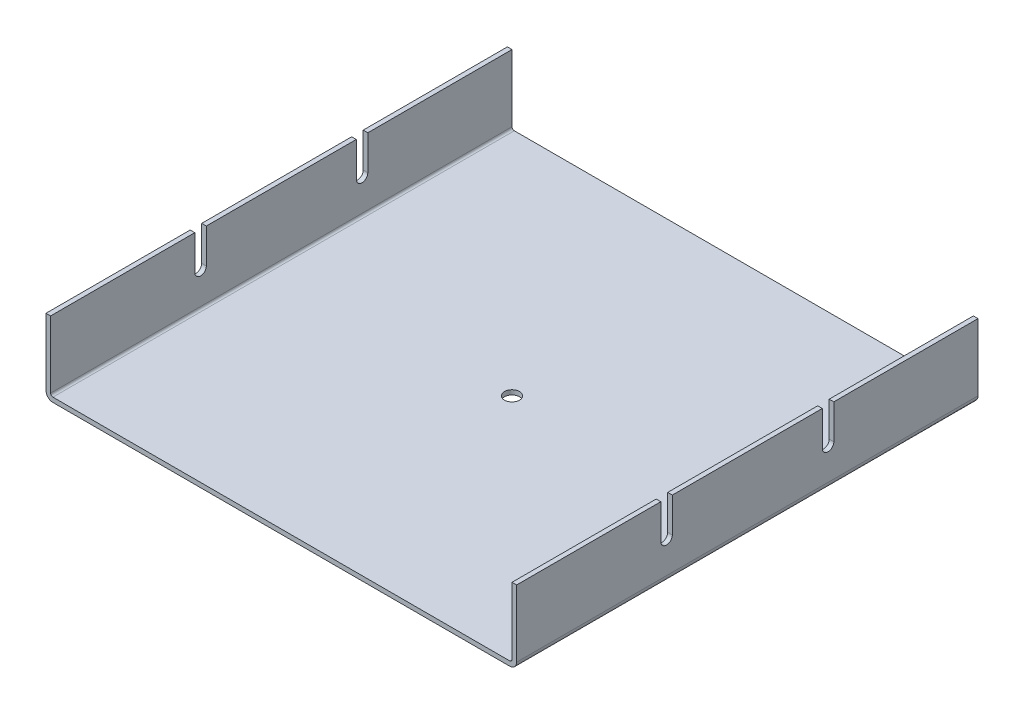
SolidWorks part; units mm, degrees
ref_plane "Plan de face" through (0, 0, 0) normal (0, 0, 1) x (1, 0, 0)
ref_plane "Plan de dessus" through (0, 0, 0) normal (0, 1, 0) x (1, 0, 0)
ref_plane "Plan de droite" through (0, 0, 0) normal (1, 0, 0) x (0, 0, -1)
sketch "Esquisse1" plane through (0, 0, 0) normal (0, 0, 1) x (1, 0, 0)
  line L0 (102, 1) -> (102, 30)
  line L1 (-99, 0) -> (99, 0)
  line L2 (-100, 1) -> (-100, 30)
  line L3 (-99, -2) -> (99, -2)
  line L4 (100, 1) -> (100, 30)
  line L5 (-102, 1) -> (-102, 30)
  line L6 (-102, 30) -> (-100, 30)
  line L7 (100, 30) -> (102, 30)
  line L8 (-100, 0) -> (100, 0) construction
  line L9 (-100, 0) -> (-100, 30) construction
  line L10 (100, 0) -> (100, 30) construction
  line L11 (-102, -2) -> (102, -2) construction
  line L12 (-102, -2) -> (-102, 30) construction
  line L13 (102, -2) -> (102, 30) construction
  arc A0 (-99, 0) -> (-100, 1) centre (-99, 1) cw
  arc A1 (99, 0) -> (100, 1) centre (99, 1) ccw
  arc A2 (-99, -2) -> (-102, 1) centre (-99, 1) cw
  arc A3 (102, 1) -> (99, -2) centre (99, 1) cw
  point P12 (-100, 0)
  dimension "D5" = 1
  dimension "D1" = 3
  dimension "D2" = 100
  dimension "D3" = 30
  dimension "D6" = 200
  dimension "D4" = 2
extrude "Extrusion1" add sketch "Esquisse1" along normal mid plane 200
sketch "Esquisse2" plane through (0, -2, 0) normal (0, -1, 0) x (1, 0, 0)
  circle A0 centre (0, 0) radius 3.25
  dimension "D1" = 6.5
extrude "Enlèv. mat.-Extru.1" cut sketch "Esquisse2" against normal through all
sketch "Esquisse3" plane through (-102, 0, 0) normal (-1, 0, 0) x (0, 0, 1)
  line L0 (100, 30) -> (-100, 30) construction
  line L1 (-37.5, 30) -> (-32.5, 30)
  line L2 (-37.5, 30) -> (-37.5, 15)
  line L3 (0, 0) -> (0, 43.0063) construction
  line L4 (-32.5, 30) -> (-32.5, 15)
  line L5 (32.5, 30) -> (32.5, 15)
  line L6 (37.5, 30) -> (37.5, 15)
  line L7 (37.5, 30) -> (32.5, 30)
  arc A0 (-37.5, 15) -> (-32.5, 15) centre (-35, 15) ccw
  arc A1 (37.5, 15) -> (32.5, 15) centre (35, 15) cw
  dimension "D2" = 15
  dimension "D1" = 5
  dimension "D3" = 35
extrude "Enlèv. mat.-Extru.2" cut sketch "Esquisse3" against normal through all
